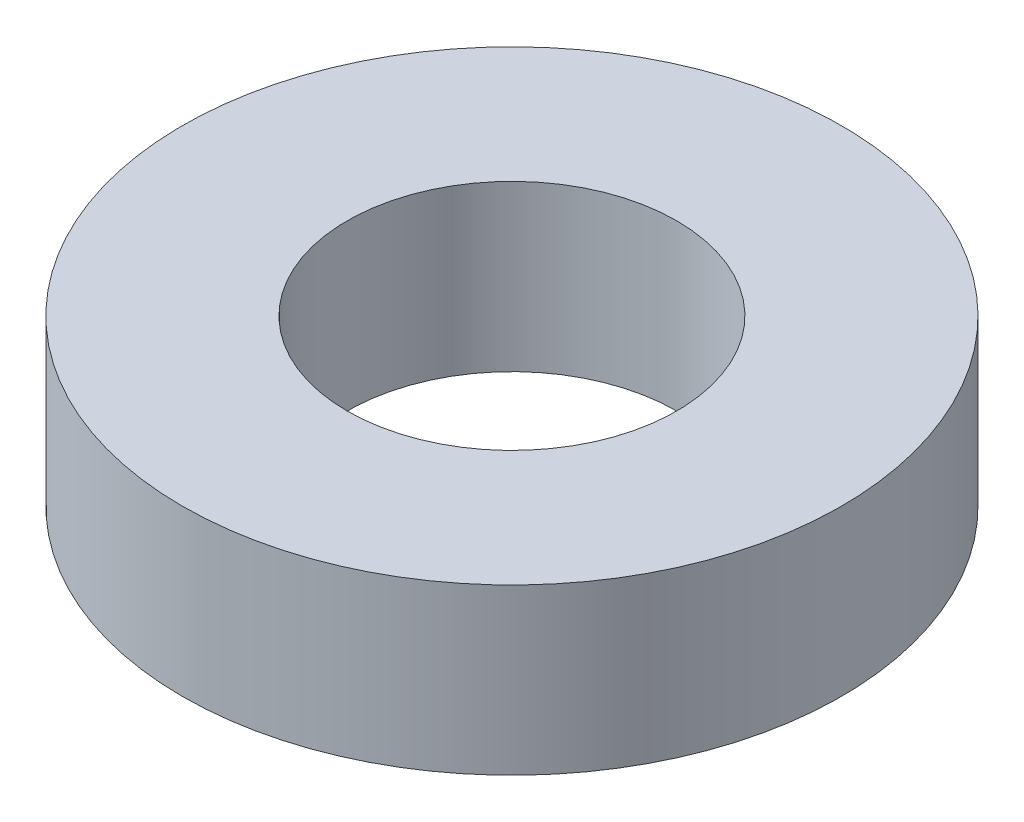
SolidWorks part; units mm, degrees
ref_plane "前视基准面" through (0, 0, 0) normal (0, 0, 1) x (1, 0, 0)
ref_plane "上视基准面" through (0, 0, 0) normal (0, 1, 0) x (1, 0, 0)
ref_plane "右视基准面" through (0, 0, 0) normal (1, 0, 0) x (0, 0, -1)
sketch "草图1" plane through (0, 0, 0) normal (0, 1, 0) x (1, 0, 0)
  circle A0 centre (0, 0) radius 5
  circle A1 centre (0, 0) radius 10
  dimension "D1" = 10
  dimension "D2" = 20
extrude "凸台-拉伸1" add sketch "草图1" along normal blind 5
